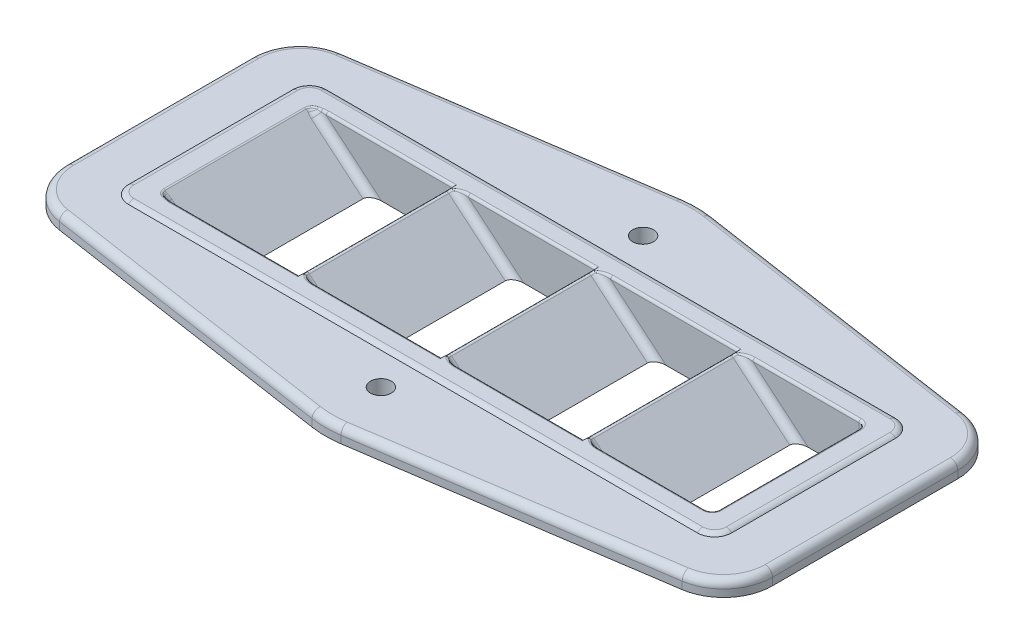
SolidWorks part; units mm, degrees
ref_plane "Front Plane" through (0, 0, 0) normal (0, 0, 1) x (1, 0, 0)
ref_plane "Top Plane" through (0, 0, 0) normal (0, 1, 0) x (1, 0, 0)
ref_plane "Right Plane" through (0, 0, 0) normal (1, 0, 0) x (0, 0, -1)
sketch "Sketch2" plane through (0, 0, 0) normal (0, 1, 0) x (1, 0, 0)
  line L0 (0, 8.6178) -> (0, 46.3822)
  line L1 (8.5233, 56.2726) -> (69.0466, 65.309)
  line L2 (74.9534, 65.309) -> (135.4767, 56.2726)
  line L3 (144, 46.3822) -> (144, 8.6178)
  line L4 (135.4767, -1.2726) -> (74.9534, -10.309)
  line L5 (69.0466, -10.309) -> (8.5233, -1.2726)
  line L6 (72, -10.75) -> (72, 65.75) construction
  arc A0 (135.4767, 56.2726) -> (144, 46.3822) centre (134, 46.3822) cw
  arc A1 (144, 8.6178) -> (135.4767, -1.2726) centre (134, 8.6178) cw
  arc A2 (0, 8.6178) -> (8.5233, -1.2726) centre (10, 8.6178) ccw
  arc A3 (0, 46.3822) -> (8.5233, 56.2726) centre (10, 46.3822) cw
  arc A4 (74.9534, -10.309) -> (69.0466, -10.309) centre (72, 9.4717) cw
  arc A5 (69.0466, 65.309) -> (74.9534, 65.309) centre (72, 45.5283) cw
  point P3 (0, 27.5)
  point P8 (72, 27.5)
  point P9 (144, 27.5)
  point P12 (144, 55)
  point P17 (0, 0)
  point P20 (0, 55)
  dimension "D6" = 10
  dimension "D7" = 20
  dimension "D1" = 55
  dimension "D2" = 72
  dimension "D3" = 72
  dimension "D4" = 72
  dimension "D5" = 76.5
extrude "Boss-Extrude1" add sketch "Sketch2" against normal blind 3
sketch "Sketch4" plane through (0, 0, 0) normal (0, 1, 0) x (1, 0, 0)
  line L0 (72, 65.5283) -> (72, -10.5283) construction
  line L1 (130, 47.7) -> (14, 47.7)
  line L2 (133.5, 44.2) -> (133.5, 10.8)
  line L3 (130, 7.3) -> (14, 7.3)
  line L4 (10.5, 44.2) -> (10.5, 10.8)
  line L5 (133.5, 47.7) -> (10.5, 7.3) construction
  line L6 (133.5, 7.3) -> (10.5, 47.7) construction
  arc A0 (74.9534, 65.309) -> (69.0466, 65.309) centre (72, 45.5283) ccw construction
  arc A1 (69.0466, -10.309) -> (74.9534, -10.309) centre (72, 9.4717) ccw construction
  arc A2 (130, 47.7) -> (133.5, 44.2) centre (130, 44.2) cw
  arc A3 (133.5, 10.8) -> (130, 7.3) centre (130, 10.8) cw
  arc A4 (14, 7.3) -> (10.5, 10.8) centre (14, 10.8) cw
  arc A5 (14, 47.7) -> (10.5, 44.2) centre (14, 44.2) ccw
  point P0 (72, 27.5)
  point P14 (72, 27.5)
  dimension "D3" = 3.5
  dimension "D1" = 40.4
  dimension "D2" = 123
extrude "Boss-Extrude2" add sketch "Sketch4" along normal blind 0.5
sketch "Sketch3" plane through (0, 0, 0) normal (0, 1, 0) x (1, 0, 0)
  line L0 (72, 65.5283) -> (72, -10.5283) construction
  line L1 (0, 27.5) -> (144, 27.5) construction
  line L2 (0, 46.3822) -> (0, 8.6178) construction
  line L3 (144, 8.6178) -> (144, 46.3822) construction
  arc A0 (74.9534, 65.309) -> (69.0466, 65.309) centre (72, 45.5283) ccw construction
  arc A1 (69.0466, -10.309) -> (74.9534, -10.309) centre (72, 9.4717) ccw construction
  circle A2 centre (72, 54.2283) radius 2.125
  circle A3 centre (72, 0.7717) radius 2.125
  dimension "D1" = 4.25
  dimension "D2" = 11.3
extrude "Cut-Extrude1" cut sketch "Sketch3" against normal through all both and the other way through all
sketch "Sketch5" plane through (0, 0.5, 0) normal (0, 1, 0) x (1, 0, 0)
  line L0 (72, 7.3) -> (72, 47.7) construction
  line L1 (14, 7.3) -> (130, 7.3) construction
  line L2 (130, 47.7) -> (14, 47.7) construction
  line L4 (127, 43.2) -> (17, 43.2)
  line L5 (128.5, 41.7) -> (128.5, 13.3)
  line L6 (127, 11.8) -> (17, 11.8)
  line L7 (15.5, 41.7) -> (15.5, 13.3)
  line L8 (128.5, 43.2) -> (15.5, 11.8) construction
  line L9 (128.5, 11.8) -> (15.5, 43.2) construction
  arc A0 (127, 43.2) -> (128.5, 41.7) centre (127, 41.7) cw
  arc A1 (128.5, 13.3) -> (127, 11.8) centre (127, 13.3) cw
  arc A2 (17, 11.8) -> (15.5, 13.3) centre (17, 13.3) cw
  arc A3 (17, 43.2) -> (15.5, 41.7) centre (17, 41.7) ccw
  point P6 (72, 27.5)
  dimension "D3" = 1.5
  dimension "D1" = 31.4
  dimension "D2" = 113
extrude "Cut-Extrude3" cut sketch "Sketch5" against normal through all both and the other way through all
sketch3d "3DSketch4" plane through (0, 0, 0) normal (0, 0, 1) x (1, 0, 0)
  dimension "D1" = 40
sketch "Sketch12" plane through (6.6504, 7.9257, 0) normal (0.6428, 0.766, 0) x (0.766, -0.6428, 0)
  line L0 (96.9663, 11.8) -> (12.7014, 11.8) construction
  line L1 (11.5523, 43.2) -> (32.5523, 43.2)
  line L2 (11.5523, 43.2) -> (11.5523, 11.8)
  line L3 (11.5523, 11.8) -> (32.5523, 11.8)
  line L4 (32.5523, 43.2) -> (32.5523, 11.8)
  dimension "D1" = 21
  dimension "D2" = 31.4
extrude "Boss-Extrude3" add sketch "Sketch12" against normal blind 1.5
pattern_linear "LPattern1" count 4 spacing 29 along (1, 0, 0) of "Boss-Extrude3"
sketch "Sketch13" plane through (0, -3, 0) normal (0, -1, 0) x (1, 0, 0)
  line L0 (127, -11.8) -> (17, -11.8)
  line L1 (15.5, -13.3) -> (15.5, -41.7)
  line L2 (17, -43.2) -> (127, -43.2)
  arc A1 (17, -11.8) -> (15.5, -13.3) centre (17, -13.3) ccw
  arc A2 (15.5, -41.7) -> (17, -43.2) centre (17, -41.7) ccw
  dimension "D1" = 1.5
sketch "Sketch14" plane through (0, 0, 0) normal (0, 0, 1) x (1, 0, 0)
  line L0 (12.1178, -3) -> (17.3376, -3)
  line L2 (17.3376, -3) -> (30.6228, -14.1476)
  line L3 (30.6228, -14.1476) -> (12.1178, -14.1476)
  line L4 (12.1178, -14.1476) -> (12.1178, -3)
  point P2 (0, 0)
extrude "Extrude-Thin1" add sketch "Sketch13" along normal blind 10 thin
sketch "Sketch16" plane through (0, 0, -10.3) normal (0, 0, 1) x (1, 0, 0)
  line L1 (131.1713, -13) -> (8.9339, -13)
  line L2 (131.1713, -13) -> (131.1713, -24.5752)
  line L3 (131.1713, -24.5752) -> (8.9339, -24.5752)
  line L4 (8.9339, -13) -> (8.9339, -24.5752)
extrude "Cut-Extrude4" cut sketch "Sketch16" against normal through all both and the other way through all
extrude "Cut-Extrude5" cut sketch "Sketch14" against normal through all both and the other way through all
fillet "Fillet1" radius 1.5 12 edges at (72, 0, 10.5283) (38.785, 0, 5.7908) (2.4248, 0, -2.0897) (0, 0, -27.5) (2.4248, 0, -52.9103) (38.785, 0, -60.7908) (72, 0, -65.5283) (105.215, 0, -60.7908) (141.5752, 0, -52.9103) (144, 0, -27.5) (141.5752, 0, -2.0897) (105.215, 0, 5.7908)
fillet "Fillet2" radius 1.5 8 edges at (132.4749, 0.5, -46.6749) (133.5, 0.5, -27.5) (132.4749, 0.5, -8.3251) (72, 0.5, -7.3) (11.5251, 0.5, -8.3251) (10.5, 0.5, -27.5) (11.5251, 0.5, -46.6749) (72, 0.5, -47.7)
fillet "Fillet3" radius 1.5 10 edges at (15.9393, 0.1314, -42.7607) (15.9393, 0.1314, -12.2393) (110.5435, -6.2493, -43.2) (81.5435, -6.2493, -43.2) (52.5435, -6.2493, -43.2) (24.2935, -6.8786, -43.2) (24.2935, -6.8786, -11.8) (52.5435, -6.2493, -11.8) (81.5435, -6.2493, -11.8) (110.5435, -6.2493, -11.8)
fillet "Fillet4" radius 1.5 8 edges at (127, -13, -43.95) (119.0684, -12.4247, -43.2) (122.7929, -13, -43.2) (122.7929, -13, -11.8) (119.0684, -12.4247, -11.8) (127, -13, -11.05) (118.8693, -12.662, -42.7607) (118.8693, -12.662, -12.2393)
fillet "Fillet5" radius 1.5 18 edges at (32.0684, -12.4247, -43.2) (44.9204, -13, -43.2) (61.0684, -12.4247, -43.2) (73.9204, -13, -43.2) (90.0684, -12.4247, -43.2) (102.9204, -13, -43.2) (32.0684, -12.4247, -11.8) (44.9204, -13, -11.8) (73.9204, -13, -11.8) (61.0684, -12.4247, -11.8) (102.9204, -13, -11.8) (90.0684, -12.4247, -11.8) (89.8693, -12.662, -42.7607) (60.8693, -12.662, -42.7607) (31.8693, -12.662, -42.7607) (31.8693, -12.662, -12.2393) (60.8693, -12.662, -12.2393) (89.8693, -12.662, -12.2393)
fillet "Fillet6" radius 0.5 25 edges at (103.1835, 0.5, -42.7607) (102.5, 0.5, -27.5) (103.1835, 0.5, -12.2393) (115.9168, 0.5, -11.8) (128.0607, 0.5, -12.2393) (128.5, 0.5, -27.5) (128.0607, 0.5, -42.7607) (74.1835, 0.5, -42.7607) (73.5, 0.5, -27.5) (74.1835, 0.5, -12.2393) (45.1835, 0.5, -12.2393) (44.5, 0.5, -27.5) (45.1835, 0.5, -42.7607) (31.1668, 0.5, -11.8) (17.4168, 0.5, -11.8) (15.9393, 0.5, -12.2393) (31.1668, 0.5, -43.2) (17.4168, 0.5, -43.2) (15.9393, 0.5, -42.7607) (115.9168, 0.5, -43.2) (89.1668, 0.5, -43.2) (89.1668, 0.5, -11.8) (60.1668, 0.5, -11.8) (60.1668, 0.5, -43.2) (15.5, 0.5, -27.5)
fillet "Fillet7" radius 2 2 edges at (23.2963, -8, -10.3) (23.2963, -8, -44.7)
fillet "Fillet8" radius 1 3 edges at (15.9393, -3, -12.2393) (15.9393, -3, -42.7607) (15.5, -3, -27.5)
fillet "Fillet9" radius 1 9 edges at (73.7245, -3, -44.7) (19.1203, -3, -44.5085) (17.7494, -2.9507, -43.7576) (15.5, -1.4581, -27.5) (17.6341, -2.9096, -11.3142) (19.1203, -3, -10.4915) (73.7245, -3, -10.3)
sketch "Sketch17" plane through (0, 0, 0) normal (0, 0, 1) x (1, 0, 0)
  line L0 (8.5233, -3) -> (69.0466, -3) construction
  line L1 (2.0431, -9.5) -> (146.4509, -9.5)
  line L2 (2.0431, -9.5) -> (2.0431, -21.1845)
  line L3 (2.0431, -21.1845) -> (146.4509, -21.1845)
  line L4 (146.4509, -9.5) -> (146.4509, -21.1845)
  dimension "D1" = 6.5
extrude "Cut-Extrude6" cut sketch "Sketch17" against normal through all both and the other way through all
